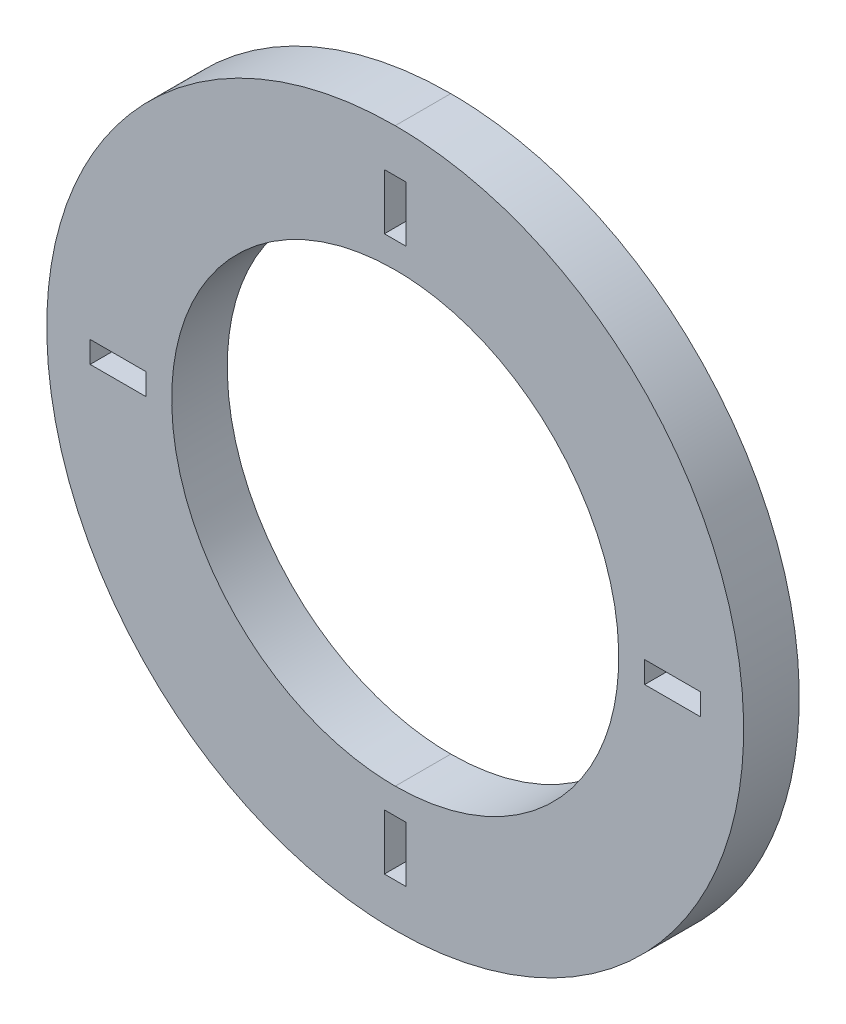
SolidWorks part; units mm, degrees
ref_plane "Alzado" through (0, 0, 0) normal (0, 0, 1) x (1, 0, 0)
ref_plane "Planta" through (0, 0, 0) normal (0, 1, 0) x (1, 0, 0)
ref_plane "Vista lateral" through (0, 0, 0) normal (1, 0, 0) x (0, 0, -1)
sketch "Croquis2" plane through (0, 0, 0) normal (0, 0, 1) x (1, 0, 0)
sketch_block_instance "F1 CAR CUT corte-1"
sketch_block "Bloque1"
extrude "Saliente-Extruir1" add sketch "Croquis2" along normal blind 3
delete or keep bodies "Sólido-Eliminar/Conservar 27" type delete bodies bodies 109 105 110 106 111 107
delete or keep bodies "Sólido-Eliminar/Conservar 30" type delete bodies bodies 108 104 113 114 103 112
delete or keep bodies "Sólido-Eliminar/Conservar 31" type delete bodies bodies 102
